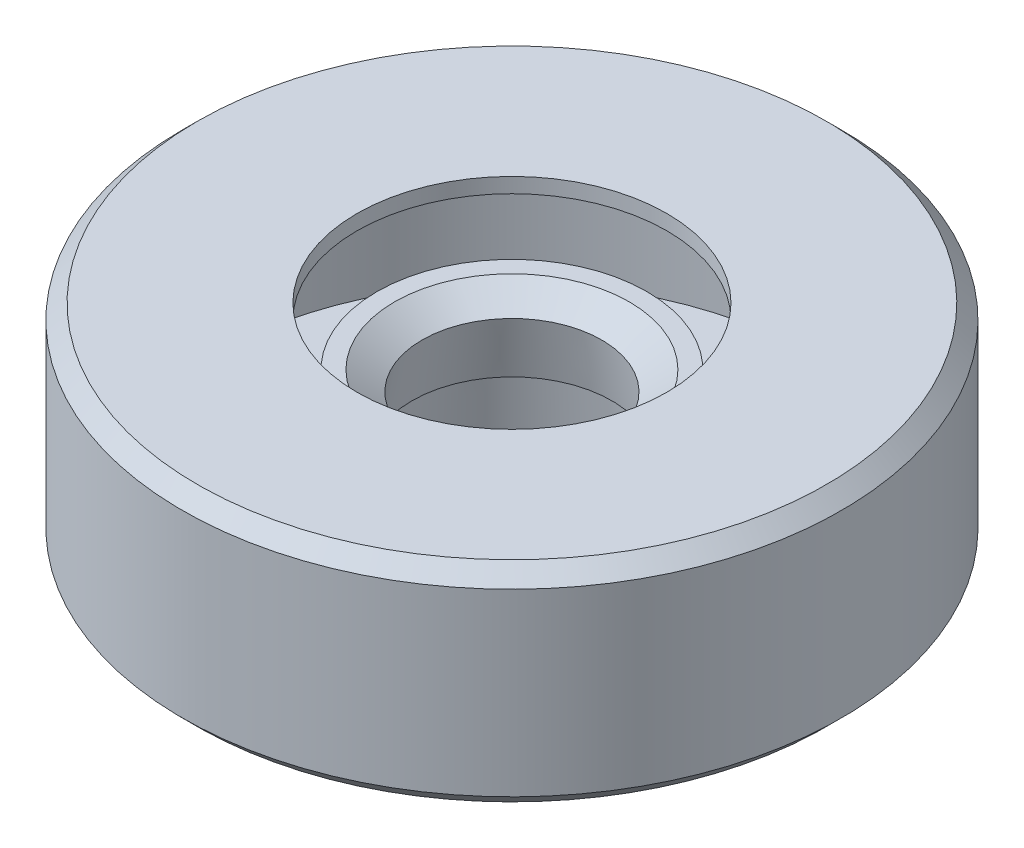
SolidWorks part; units mm, degrees
ref_plane "前视基准面" through (0, 0, 0) normal (0, 0, 1) x (1, 0, 0)
ref_plane "上视基准面" through (0, 0, 0) normal (0, 1, 0) x (1, 0, 0)
ref_plane "右视基准面" through (0, 0, 0) normal (1, 0, 0) x (0, 0, -1)
sketch "草图1" plane through (0, 0, 0) normal (0, 0, 1) x (1, 0, 0)
  line L0 (0, 5.8362) -> (0, -13.0481) construction
  line L1 (-10, 0.5) -> (-5.524, 0.5)
  line L2 (-10.5, 0) -> (-4.0588, 0)
  line L3 (-4.4634, 1.1124) -> (-5.1705, 1.1124)
  line L4 (-11, 6.5) -> (-11, 0.5)
  line L5 (-10, 0.5) -> (-10, 6.5)
  line L6 (-11, 0.5) -> (-10.5, 0)
  line L7 (-11, 6.5) -> (-10.5, 7)
  line L8 (-10.5, 0) -> (-10.5, 0.5) construction
  line L9 (-3.3401, 2.5) -> (-3, 4.4286)
  line L10 (-3.3401, 2.5) -> (-3.8401, 2.5)
  line L11 (-4.0588, 0) -> (-3.8401, 2.5)
  line L12 (-4.307, 2.9) -> (-4.4634, 1.1124)
  line L13 (-3.9181, 5.0714) -> (-4.507, 5.0714)
  line L14 (-4.507, 5.0714) -> (-4.507, 3.7472)
  line L15 (-3, 4.4286) -> (-3.9181, 5.0714)
  line L16 (-5.1705, 1.1124) -> (-5.524, 0.5)
  line L17 (-5.1705, 7) -> (-10.5, 7)
  line L18 (-10, 6.5) -> (-5.1705, 6.5)
  line L19 (-5.1705, 6.5) -> (-5.1705, 7)
  line L20 (-4.4142, 1.674) -> (-3.9161, 1.6305) construction
  line L21 (-10.5, 0.5) -> (-10, 0.5) construction
  arc A0 (-4.507, 3.7472) -> (-4.307, 2.9) centre (-4.307, 3.3472) ccw
  dimension "D10" = 0.2
  dimension "D6" = 1.9286
  dimension "D11" = 100
  dimension "b" = 7
  dimension "D2" = 45
  dimension "D3" = 45
  dimension "D5" = 2.5
  dimension "D7" = 0.6429
  dimension "D8" = 95
  dimension "D9" = 0.4
  dimension "D12" = 120
  dimension "D13" = 145
  dimension "D14" = 0.4
  dimension "dm" = 22
  dimension "d1" = 6
  dimension "r" = 0.5
revolve "旋转1" add sketch "草图1" angle 360 about L0
equation "\"D5@草图1\" = \"b@草图1\" / 2 -1"
equation "\"D6@草图1\" =  ( \"b@草图1\" - \"D5@草图1\" )  / 7 * 3"
equation "\"D7@草图1\" = \"D6@草图1\" / 3"
equation "\"D9@草图1\" = \"r@草图1\" / 5 * 4"
equation "\"D14@草图1\" = \"D9@草图1\""
equation "\"D10@草图1\" = \"D9@草图1\" / 2"
